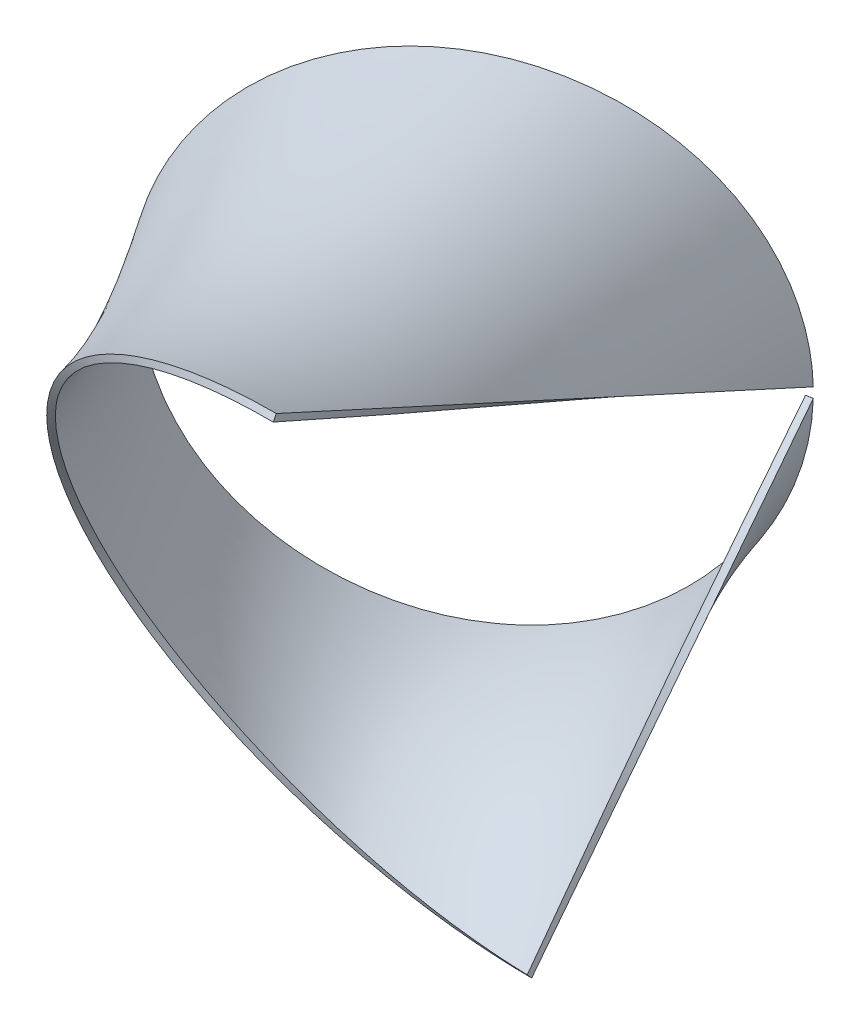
SolidWorks part; units mm, degrees
ref_plane "Ebene vorne" through (0, 0, 0) normal (0, 0, 1) x (1, 0, 0)
ref_plane "Ebene oben" through (0, 0, 0) normal (0, 1, 0) x (1, 0, 0)
ref_plane "Ebene rechts" through (0, 0, 0) normal (1, 0, 0) x (0, 0, -1)
sketch "Skizze1" plane through (0, 0, 0) normal (0, 0, 1) x (1, 0, 0)
  line L0 (0, 0) -> (0, 100) construction
  line L1 (0, 0) -> (-147.7193, 0) construction
  arc A0 (0, 100) -> (0, -100) centre (0, 0) ccw
  dimension "D1" = 200
ref_plane "Ebene1" through (0, 0, -150) normal (0, 0, 1) x (1, 0, 0)
sketch "Skizze7" plane through (0, 0, -150) normal (0, 0, 1) x (1, 0, 0)
  line L0 (0, 0) -> (0, 129.1401) construction
  line L1 (0, 0) -> (81.7532, 0) construction
ref_plane "Ebene2" through (-64.9519, 0, -112.5) normal (0.5, 0, 0.866) x (0.866, 0, -0.5)
sketch "Skizze8" plane through (-64.9519, 0, -112.5) normal (0.5, 0, 0.866) x (0.866, 0, -0.5)
  line L0 (75, 0) -> (-65.4275, 0) construction
  arc A0 (54.985, 1.5) -> (54.985, -1.5) centre (-20, 0) ccw
  dimension "D1" = 150
  dimension "D3" = 3
  dimension "D2" = 95
ref_plane "Ebene3" through (0, 0, 0) normal (0, -0.3827, 0.9239) x (1, 0, 0)
sketch "Skizze10" plane through (0, 0, 0) normal (0, -0.3827, 0.9239) x (1, 0, 0)
  line L0 (0, 0) -> (0, 100) construction
  line L1 (0, 0) -> (-73.8596, 0) construction
  arc A0 (0, 100) -> (0, -100) centre (0, 0) ccw
  dimension "D1" = 200
sheet metal parameters "Blech11" thickness 2 parameters "D1"=3, "Dicke"=2
lofted bend "Ausgeformte Biegungen13" parameters "D1"=0, "D12"=2
other "Freiform-Biegung6" parameters "D1"=1000, "D4"=57.296, "D5"=1
ref_plane "Ebene5" through (0, 0, 0) normal (-0.9911, -0.0511, 0.1233) x (0.1231, 0.0063, 0.9924)
flat pattern "Abwicklung6"
sketch "Biegung-Linien6" plane through (0, 0, 0) normal (0, 1, 0) x (-1, 0, 0)
other "Abwickeln-<Freiform-Biegung6>1"
equation "\"LÄNGE\"=0"
equation "\"BREITE\"=0"
equation "\"HÖHE\"=0"
equation "\"DURCHMESSER\"=0"
